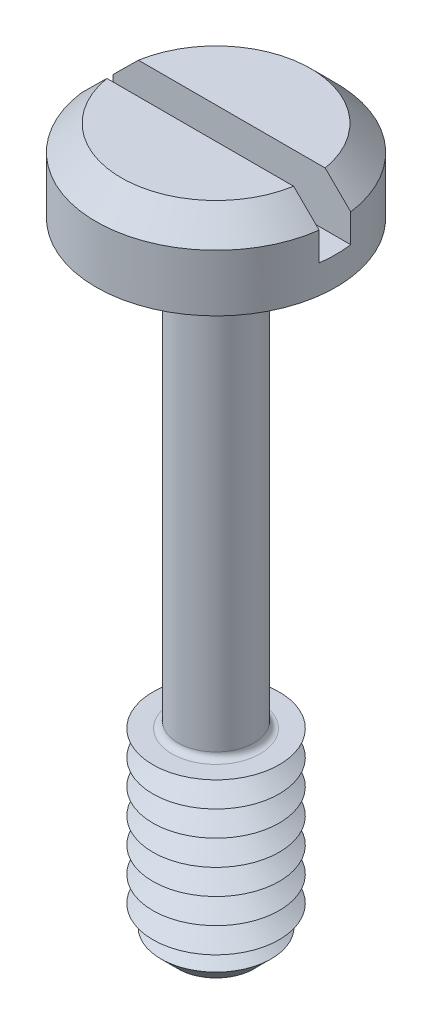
SolidWorks part; units mm, degrees
ref_plane "Front Plane" through (0, 0, 0) normal (0, 0, 1) x (1, 0, 0)
ref_plane "Top Plane" through (0, 0, 0) normal (0, 1, 0) x (1, 0, 0)
ref_plane "Right Plane" through (0, 0, 0) normal (1, 0, 0) x (0, 0, -1)
sketch "Sketch1" plane through (0, 0, 0) normal (0, 1, 0) x (1, 0, 0)
  circle A0 centre (0, 0) radius 1.9
  dimension "D1" = 3.8
extrude "Boss-Extrude1" add sketch "Sketch1" along normal blind 1.3
sketch "Sketch2" plane through (0, 0, 0) normal (0, -1, 0) x (1, 0, 0)
  circle A0 centre (0, 0) radius 0.6
  dimension "D1" = 1.2
extrude "Boss-Extrude2" add sketch "Sketch2" along normal blind 10
sketch "Sketch3" plane through (0, -10, 0) normal (0, -1, 0) x (1, 0, 0)
  circle A0 centre (0, 0) radius 1
  dimension "D1" = 2
extrude "Boss-Extrude3" add sketch "Sketch3" against normal blind 3
chamfer "Chamfer1" distance 0.4 angle 45 1 edges at (0, -10, -1)
sketch "Sketch4" plane through (0, 0, 0) normal (1, 0, 0) x (0, 0, -1)
  line L0 (0, -6.5871) -> (0, -12.0372) construction
sketch "Sketch5" plane through (0, 0, 0) normal (1, 0, 0) x (0, 0, -1)
  line L0 (-1, -7) -> (-0.6536, -7.2)
  line L1 (-0.6536, -7.2) -> (-1, -7.4)
  line L2 (-1, -7) -> (-1, -9.6) construction
  line L3 (-1, -7.4) -> (-1, -7)
  dimension "D1" = 0.4
revolve "Cut-Revolve1" cut sketch "Sketch5" angle 360 about L0
pattern_linear "LPattern1" count 7 spacing 0.4 along (0, -1, 0) of "Cut-Revolve1"
fillet "Fillet1" radius 0.1 2 edges at (0, -7, -0.6) (0, 0, -0.6)
chamfer "Chamfer2" distance 0.4 angle 45 1 edges at (0, 1.3, 1.9)
sketch "Sketch6" plane through (0, 1.3, 0) normal (0, 1, 0) x (1, 0, 0)
  line L1 (1.9, -0.25) -> (-1.9, -0.25)
  line L2 (1.9, -0.25) -> (1.9, 0.25)
  line L3 (1.9, 0.25) -> (-1.9, 0.25)
  line L4 (-1.9, -0.25) -> (-1.9, 0.25)
  line L5 (1.9, -0.25) -> (-1.9, 0.25) construction
  line L6 (1.9, 0.25) -> (-1.9, -0.25) construction
  circle A0 centre (0, 0) radius 1.9 construction
  point P0 (0, 0)
  dimension "D1" = 0.5
extrude "Cut-Extrude1" cut sketch "Sketch6" against normal blind 0.85
